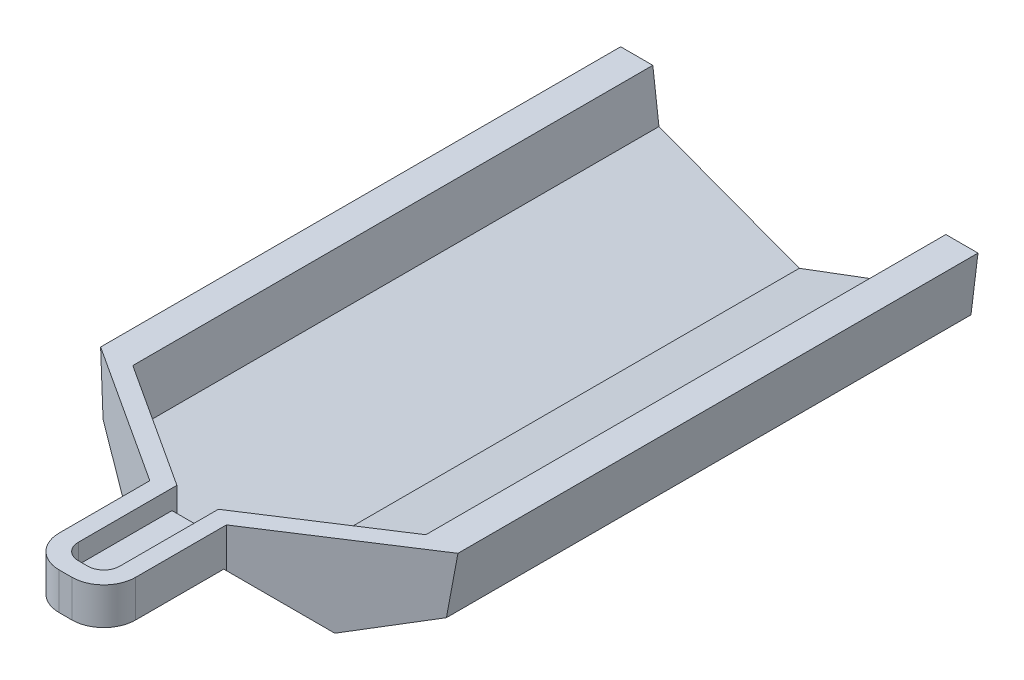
SolidWorks part; units mm, degrees
ref_plane "Plan de face" through (0, 0, 0) normal (0, 0, 1) x (1, 0, 0)
ref_plane "Plan de dessus" through (0, 0, 0) normal (0, 1, 0) x (1, 0, 0)
ref_plane "Plan de droite" through (0, 0, 0) normal (1, 0, 0) x (0, 0, -1)
sketch "Esquisse1" plane through (0, 0, 0) normal (0, 0, 1) x (1, 0, 0)
  line L0 (56, 38) -> (-56, 38)
  line L1 (0, 0) -> (0, 65.8252) construction
  line L3 (0, 0) -> (53.8064, 20.1342)
  line L4 (53.8064, 20.1342) -> (56, 38)
  line L7 (56, 38) -> (56, -19.733) construction
  line L8 (0, 0) -> (-53.8064, 20.1342)
  line L9 (-53.8064, 20.1342) -> (-56, 38)
  dimension "D4" = 7
  dimension "D5" = 18
  dimension "D6" = 56
extrude "Extrusion2" add sketch "Esquisse1" along normal blind 230
sketch "Esquisse3" plane through (0, 38, 0) normal (0, 1, 0) x (-1, 0, 0)
  line L1 (56, 230) -> (12, 230)
  line L2 (-56, 230) -> (56, 230) construction
  line L3 (0, 0) -> (0, 281.7251) construction
  line L5 (12, 230) -> (12, 191.5739)
  line L6 (12, 191.5739) -> (56, 163)
  line L7 (56, 230) -> (56, 0) construction
  line L9 (56, 163) -> (56, 230)
  line L10 (-12, 230) -> (-12, 191.5739)
  line L11 (-12, 191.5739) -> (-56, 163)
  line L12 (-56, 163) -> (-56, 230)
  line L13 (-56, 230) -> (-12, 230)
  dimension "D1" = 44
  dimension "D2" = 67
  dimension "D3" = 57
extrude "Enlèv. mat.-Extru.1" cut sketch "Esquisse3" against normal through all
sketch "Esquisse5" plane through (0, 0, 0) normal (1, 0, 0) x (0, 0, -1)
  line L0 (-230, 0) -> (-230, 26.397)
  line L3 (-230, 26.397) -> (-192.397, 26.397)
  line L4 (-192.397, 26.397) -> (-166, 0)
  line L6 (-166, 0) -> (-230, 0)
  line L7 (-191.5739, 38) -> (-230, 38) construction
  dimension "D1" = 166
  dimension "D2" = 11.603
  dimension "D3" = 45
extrude "Enlèv. mat.-Extru.3" cut sketch "Esquisse5" against normal mid plane 100
shell "Coque3" thickness 5.5
fillet "Congé4" radius 10 1 edges at (-12, 32.1985, 230)
fillet "Congé5" radius 10 1 edges at (12, 32.1985, 230)
sketch "Esquisse7" plane through (0, 0, 5.5) normal (0, 0, 1) x (1, 0, 0)
  line L0 (44.0018, 22.3378) -> (45.9249, 38) construction
  line L1 (0, 5.8725) -> (44.0018, 22.3378) construction
  line L2 (-44.0018, 22.3378) -> (0, 5.8725) construction
  line L3 (45.9249, 38) -> (-45.9249, 38) construction
  line L4 (-45.9249, 38) -> (-44.0018, 22.3378) construction
  line L5 (44.0018, 22.3378) -> (45.9249, 38)
  line L6 (0, 5.8725) -> (44.0018, 22.3378)
  line L7 (-44.0018, 22.3378) -> (0, 5.8725)
  line L8 (45.9249, 38) -> (-45.9249, 38)
  line L9 (-45.9249, 38) -> (-44.0018, 22.3378)
extrude "Enlèv. mat.-Extru.5" cut sketch "Esquisse7" against normal blind 10
fillet "Congé8" radius 5 1 edges at (6.5, 34.9485, 224.5)
fillet "Congé9" radius 5 1 edges at (-6.5, 34.9485, 224.5)
sketch "Esquisse10" plane through (0, 38, 0) normal (0, 1, 0) x (-1, 0, 0)
  line L0 (45.9249, 162.9848) -> (45.9249, 0) construction
  line L1 (-45.9249, 162.9848) -> (-45.9249, 0) construction
  line L2 (-45.9249, 162.9848) -> (-6.5, 188.5877) construction
  line L3 (6.5, 188.5877) -> (45.9249, 162.9848) construction
  line L4 (6.5, 219.5) -> (6.5, 188.5877) construction
  line L5 (-1.5, 224.5) -> (1.5, 224.5) construction
  line L6 (-6.5, 188.5877) -> (-6.5, 219.5) construction
  line L7 (45.9249, 162.9848) -> (45.9249, 0)
  line L8 (-45.9249, 162.9848) -> (-45.9249, 0)
  line L9 (-45.9249, 162.9848) -> (-6.5, 188.5877)
  line L10 (6.5, 188.5877) -> (45.9249, 162.9848)
  line L11 (6.5, 219.5) -> (6.5, 188.5877)
  line L12 (-1.5, 224.5) -> (1.5, 224.5)
  line L13 (-6.5, 188.5877) -> (-6.5, 219.5)
  arc A0 (6.5, 219.5) -> (1.5, 224.5) centre (1.5, 219.5) ccw construction
  arc A1 (-1.5, 224.5) -> (-6.5, 219.5) centre (-1.5, 219.5) ccw construction
  arc A2 (6.5, 219.5) -> (1.5, 224.5) centre (1.5, 219.5) ccw
  arc A3 (-1.5, 224.5) -> (-6.5, 219.5) centre (-1.5, 219.5) ccw
